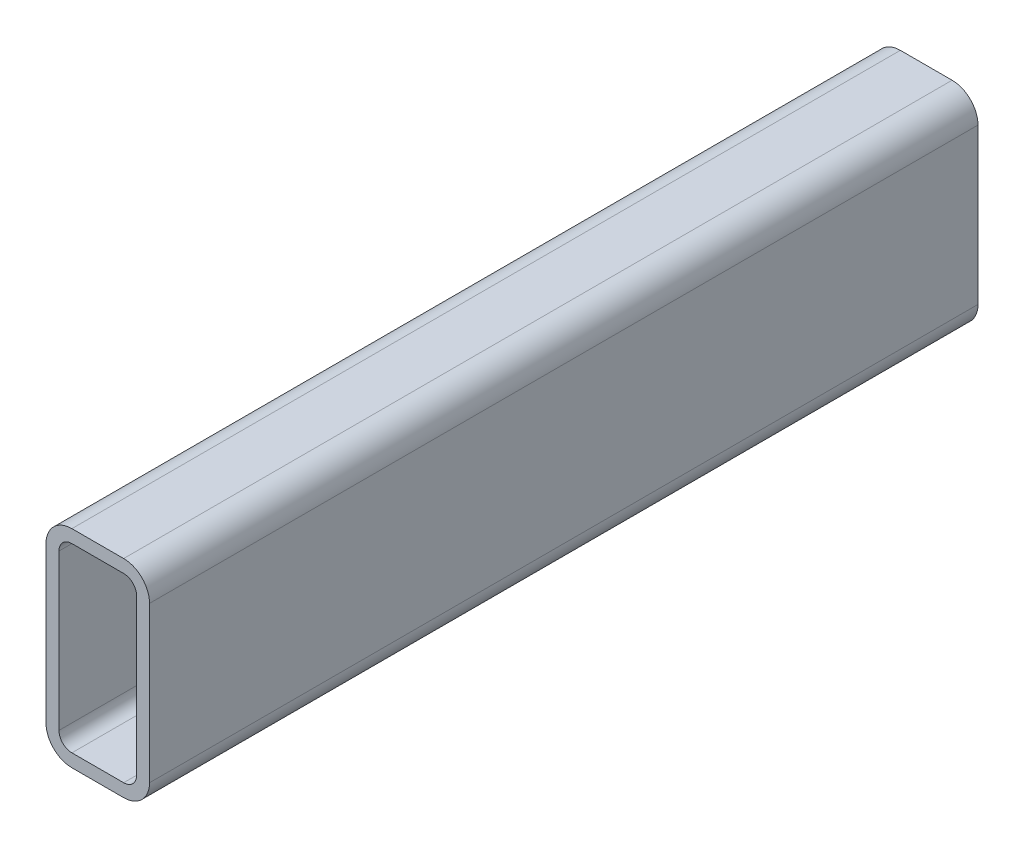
SolidWorks part; units mm, degrees
ref_plane "Front Plane" through (0, 0, 0) normal (0, 0, 1) x (1, 0, 0)
ref_plane "Top Plane" through (0, 0, 0) normal (0, 1, 0) x (1, 0, 0)
ref_plane "Right Plane" through (0, 0, 0) normal (1, 0, 0) x (0, 0, -1)
sketch "Sketch1" plane through (0, 0, 0) normal (0, 0, 1) x (1, 0, 0)
  line B0 (9.525, 76.2) -> (28.575, 76.2)
  arc B1 (38.1, 66.675) -> (28.575, 76.2) centre (28.575, 66.675) ccw
  line B2 (38.1, 66.675) -> (38.1, 9.525)
  arc B3 (28.575, 0) -> (38.1, 9.525) centre (28.575, 9.525) ccw
  line B4 (28.575, 0) -> (9.525, 0)
  arc B5 (0, 9.525) -> (9.525, 0) centre (9.525, 9.525) ccw
  line B6 (0, 9.525) -> (0, 66.675)
  arc B7 (9.525, 76.2) -> (0, 66.675) centre (9.525, 66.675) ccw
  line B8 (9.525, 71.4375) -> (28.575, 71.4375)
  arc B9 (33.3375, 66.675) -> (28.575, 71.4375) centre (28.575, 66.675) ccw
  line B10 (33.3375, 66.675) -> (33.3375, 9.525)
  arc B11 (28.575, 4.7625) -> (33.3375, 9.525) centre (28.575, 9.525) ccw
  line B12 (28.575, 4.7625) -> (9.525, 4.7625)
  arc B13 (4.7625, 9.525) -> (9.525, 4.7625) centre (9.525, 9.525) ccw
  line B14 (4.7625, 9.525) -> (4.7625, 66.675)
  arc B15 (9.525, 71.4375) -> (4.7625, 66.675) centre (9.525, 66.675) ccw
sketch_block_instance "HSS3x1.5x0.1875-1"
sketch_block "HSS3x1.5x0.1875"
extrude "Boss-Extrude1" add sketch "Sketch1" along normal blind 304.8
